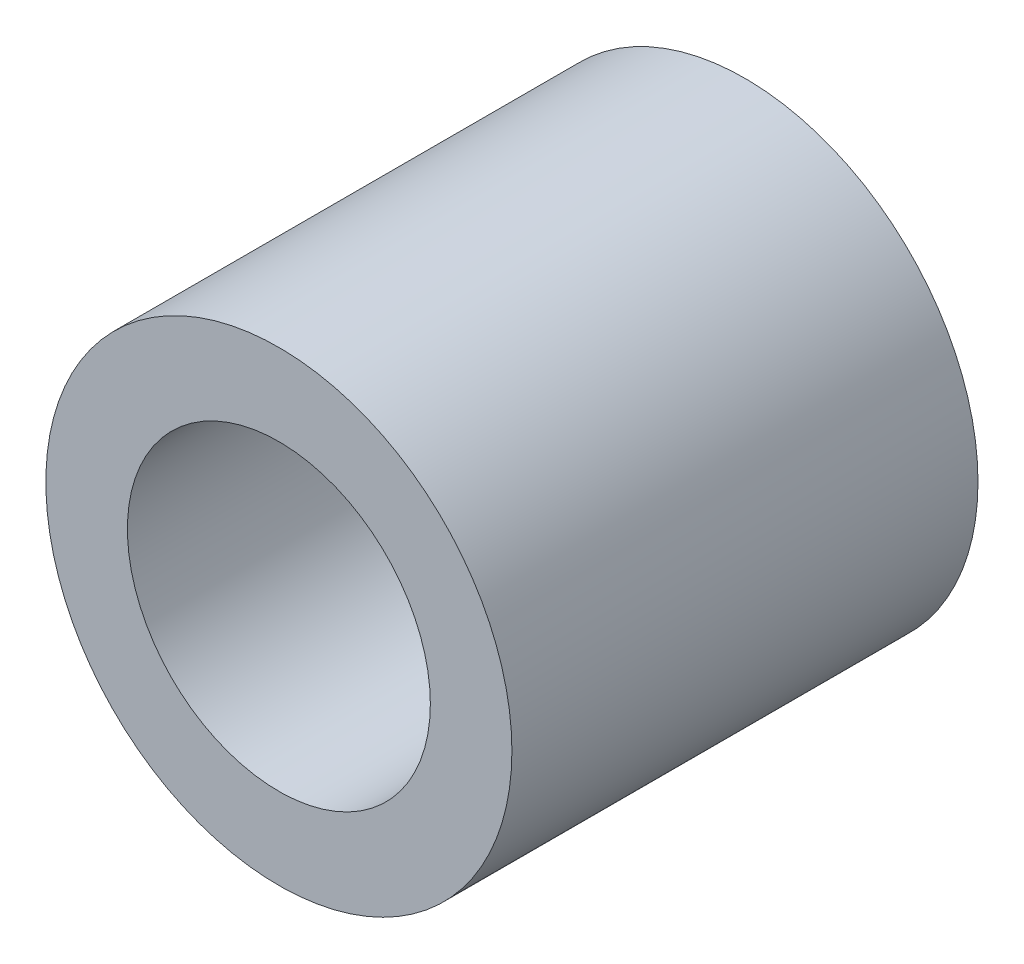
SolidWorks part; units mm, degrees
ref_plane "Front Plane" through (0, 0, 0) normal (0, 0, 1) x (1, 0, 0)
ref_plane "Top Plane" through (0, 0, 0) normal (0, 1, 0) x (1, 0, 0)
ref_plane "Right Plane" through (0, 0, 0) normal (1, 0, 0) x (0, 0, -1)
sketch "Sketch1" plane through (0, 0, 0) normal (0, 0, 1) x (1, 0, 0)
  circle A0 centre (0, 0) radius 5
  circle A1 centre (0, 0) radius 3.25
  dimension "D1" = 6.5
  dimension "D2" = 10
extrude "Extrude1" add sketch "Sketch1" along normal blind 10
